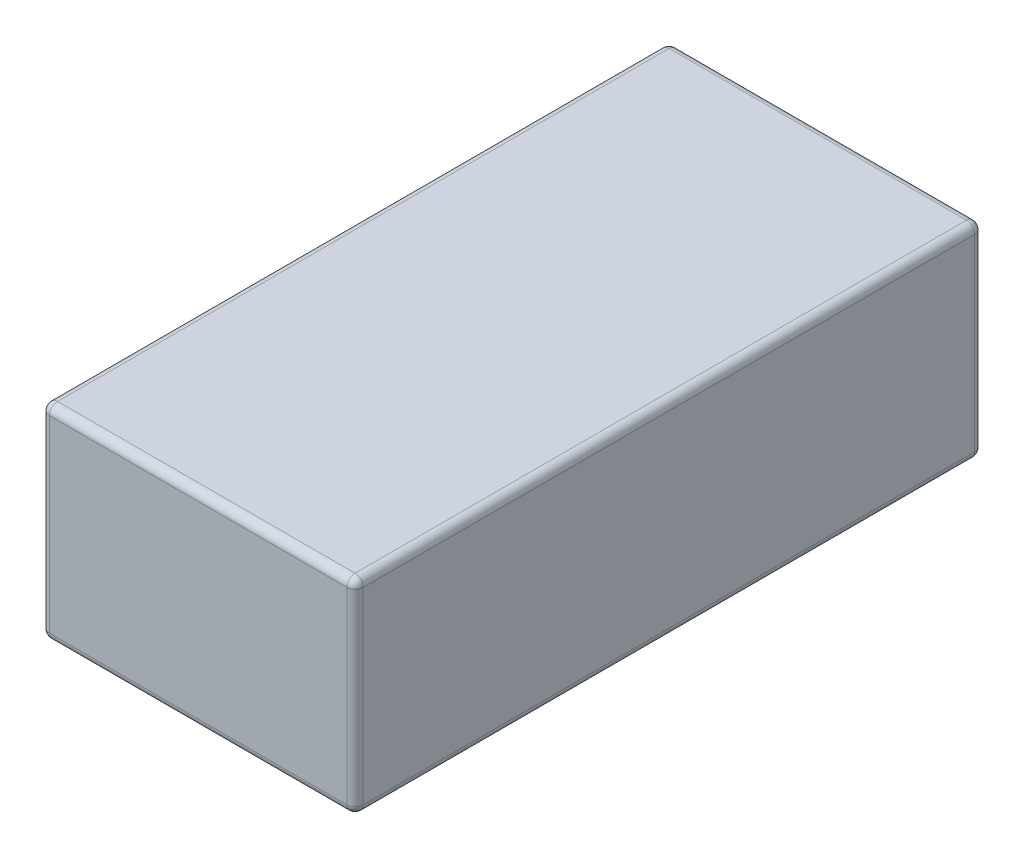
SolidWorks part; units mm, degrees
ref_plane "Front Plane" through (0, 0, 0) normal (0, 0, 1) x (1, 0, 0)
ref_plane "Top Plane" through (0, 0, 0) normal (0, 1, 0) x (1, 0, 0)
ref_plane "Right Plane" through (0, 0, 0) normal (1, 0, 0) x (0, 0, -1)
sketch "Sketch1" plane through (0, 0, 0) normal (0, 0, 1) x (1, 0, 0)
  line L1 (-57.5, 37.5) -> (57.5, 37.5)
  line L2 (-57.5, 37.5) -> (-57.5, -37.5)
  line L3 (-57.5, -37.5) -> (57.5, -37.5)
  line L4 (57.5, 37.5) -> (57.5, -37.5)
  line L5 (-57.5, 37.5) -> (57.5, -37.5) construction
  line L6 (-57.5, -37.5) -> (57.5, 37.5) construction
  point P0 (0, 0)
  dimension "D1" = 75
  dimension "D2" = 115
extrude "Boss-Extrude1" add sketch "Sketch1" along normal mid plane 230
fillet "Fillet1" radius 3 12 edges at (57.5, -37.5, 0) (-57.5, 0, 115) (57.5, 0, 115) (0, -37.5, 115) (0, 37.5, 115) (-57.5, -37.5, 0) (-57.5, 37.5, 0) (57.5, 0, -115) (0, -37.5, -115) (-57.5, 0, -115) (0, 37.5, -115) (57.5, 37.5, 0)
